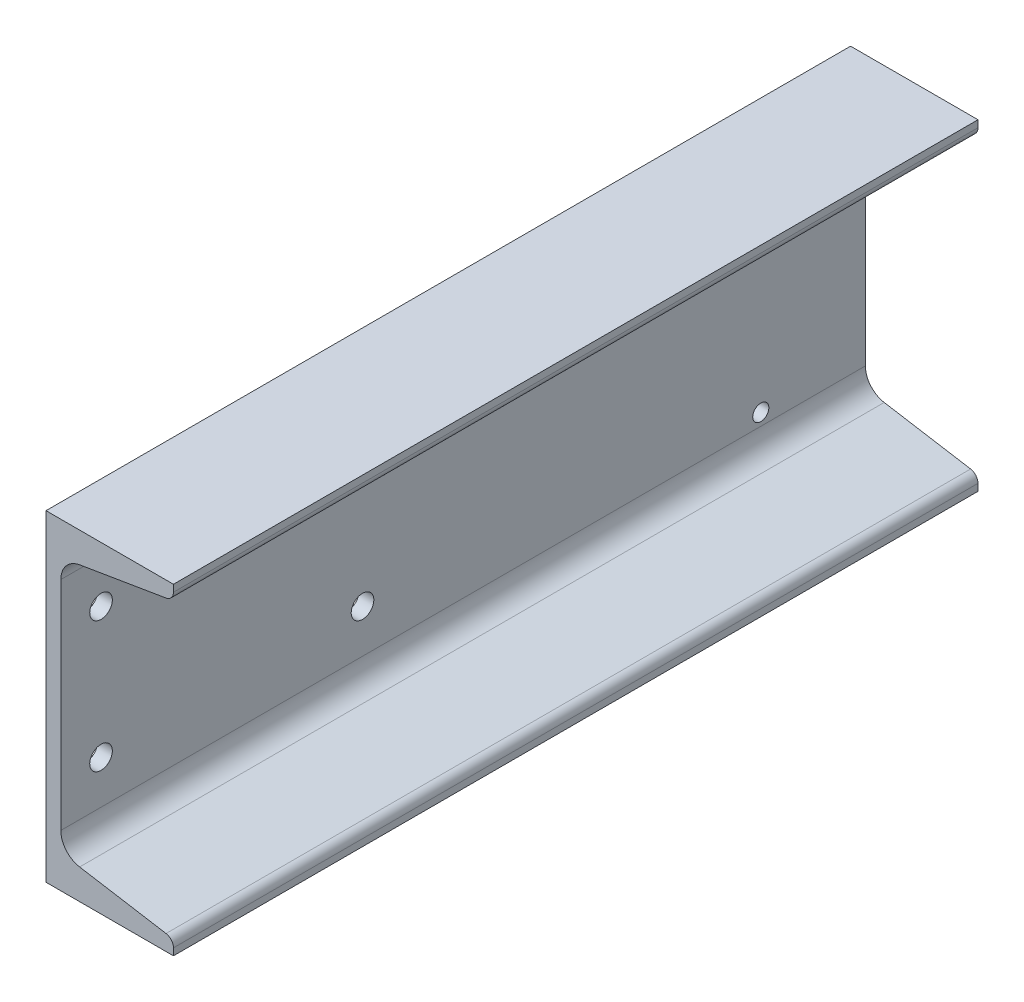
SolidWorks part; units mm, degrees
ref_plane "Front" through (0, 0, 0) normal (0, 0, 1) x (1, 0, 0)
ref_plane "Top" through (0, 0, 0) normal (0, 1, 0) x (1, 0, 0)
ref_plane "Right" through (0, 0, 0) normal (1, 0, 0) x (0, 0, -1)
extrude "Base-Extrude" add sketch "Sketch1" along normal blind 254
sketch "Sketch1" plane through (0, 0, 0) normal (0, 0, 1) x (1, 0, 0)
  line L0 (0, 0.352) -> (0, 101.952)
  line L1 (0, 101.952) -> (40.2336, 101.952)
  line L2 (0, 0.352) -> (40.2336, 0.352)
  line L12 (4.6736, 85.4453) -> (4.6736, 16.8586)
  line L15 (40.2336, 101.952) -> (40.2336, 99.764)
  line L16 (40.2336, 0.352) -> (40.2336, 2.54)
  line L17 (10.6163, 92.4606) -> (37.899, 97.008)
  line L18 (10.6163, 9.8434) -> (37.899, 5.296)
  arc A9 (4.6736, 16.8586) -> (10.6163, 9.8434) centre (11.7856, 16.8586) ccw
  arc A10 (4.6736, 85.4453) -> (10.6163, 92.4606) centre (11.7856, 85.4453) cw
  arc A11 (40.2336, 99.764) -> (37.899, 97.008) centre (37.4396, 99.764) cw
  arc A12 (40.2336, 2.54) -> (37.899, 5.296) centre (37.4396, 2.54) ccw
sketch "Sketch2" plane through (0, 0, 0) normal (-1, 0, 0) x (0, 0, 1)
  line L0 (254, 51.152) -> (67.6678, 51.152) construction
  line L1 (254, 101.952) -> (254, 0.352) construction
  line L2 (158.75, 11.374) -> (158.75, 96.6309) construction
  line L3 (254, 101.952) -> (0, 101.952) construction
  circle A0 centre (158.75, 71.7768) radius 3.5687
  dimension "D2" = 7.1374
  dimension "D1" = 95.25
  dimension "D3" = 30.1752
extrude "Cut-Extrude1" cut sketch "Sketch2" against normal through all
sketch "Sketch3" plane through (0, 0, 0) normal (-1, 0, 0) x (0, 0, 1)
  circle A0 centre (241.3, 71.7768) radius 3.5687
  circle A1 centre (158.75, 71.7768) radius 3.5687 construction
  dimension "D1" = 7.1374
  dimension "D2" = 82.55
extrude "Cut-Extrude2" cut sketch "Sketch3" against normal through all
sketch "Sketch4" plane through (0, 0, 0) normal (-1, 0, 0) x (0, 0, 1)
  circle A0 centre (158.75, 30.5018) radius 3.5687
  circle A1 centre (158.75, 71.7768) radius 3.5687 construction
  dimension "D1" = 7.1374
  dimension "D2" = 41.275
extrude "Cut-Extrude3" cut sketch "Sketch4" against normal through all
sketch "Sketch5" plane through (0, 0, 0) normal (-1, 0, 0) x (0, 0, 1)
  circle A0 centre (241.3, 30.5018) radius 3.5687
  circle A1 centre (158.75, 30.5018) radius 3.5687 construction
  dimension "D1" = 7.1374
  dimension "D2" = 82.55
extrude "Cut-Extrude4" cut sketch "Sketch5" against normal through all
sketch "Sketch6" plane through (0, 0, 0) normal (-1, 0, 0) x (0, 0, 1)
  line L2 (33.02, 101.952) -> (33.02, 0.352)
  line L3 (33.02, 101.952) -> (33.02, 0.352) construction
  line L4 (254, 101.952) -> (0, 101.952) construction
  line L5 (0, 51.152) -> (254, 51.152) construction
  line L6 (0, 101.952) -> (0, 0.352) construction
  circle A0 centre (33.02, 81.632) radius 2.54
  circle A1 centre (33.02, 20.672) radius 2.54
  dimension "D2" = 5.08
  dimension "D3" = 20.32
  dimension "D1" = 33.02
extrude "Cut-Extrude5" cut sketch "Sketch6" against normal through all
